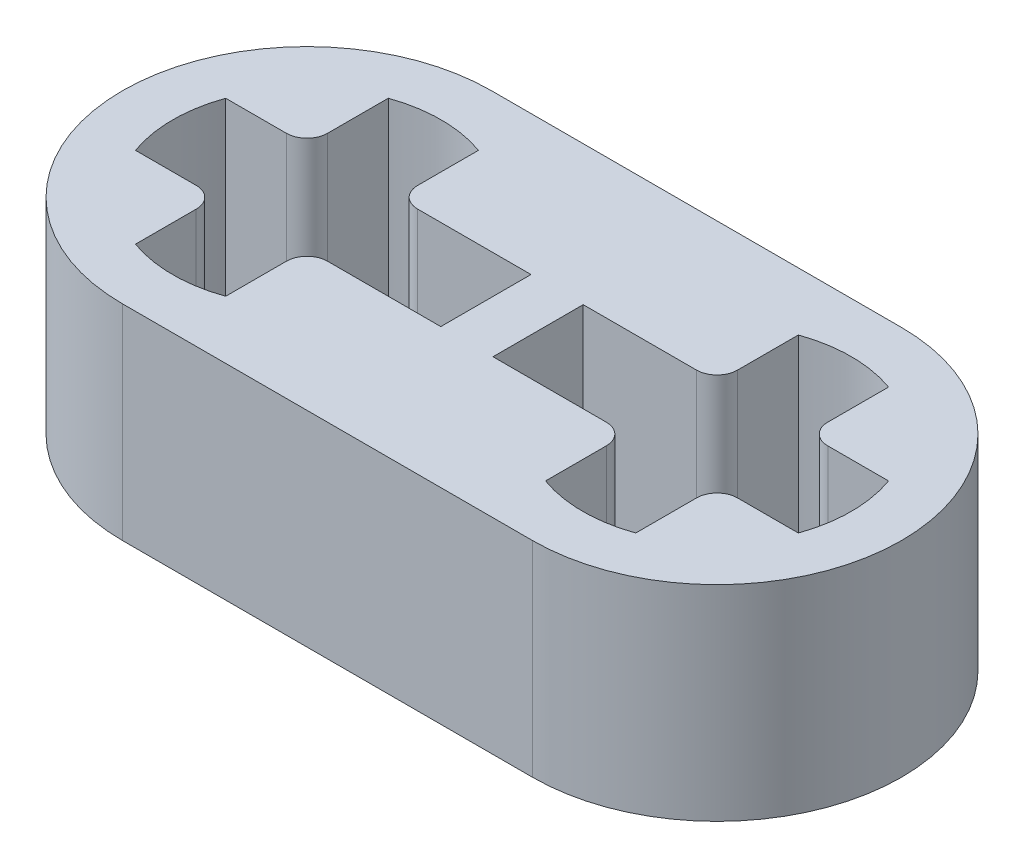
SolidWorks part; units mm, degrees
ref_plane "정면" through (0, 0, 0) normal (0, 0, 1) x (1, 0, 0)
ref_plane "윗면" through (0, 0, 0) normal (0, 1, 0) x (1, 0, 0)
ref_plane "우측면" through (0, 0, 0) normal (1, 0, 0) x (0, 0, -1)
ref_plane "평면1" through (0, 0, 0) normal (0, -1, 0) x (1, 0, 0)
sketch "스케치1" plane through (0, 0, 0) normal (0, -1, 0) x (1, 0, 0)
  line L0 (-4, -3.6) -> (4, -3.6)
  line L1 (4, 3.6) -> (-4, 3.6)
  arc A0 (4, -3.6) -> (4, 3.6) centre (4, 0) ccw
  arc A1 (-4, 3.6) -> (-4, -3.6) centre (-4, 0) ccw
  point P6 (0, 0)
  dimension "D2" = 3.6
  dimension "D3" = 4
  dimension "D1" = 8
extrude "보스-돌출1" add sketch "스케치1" against normal blind 4
sketch "스케치2" plane through (0, 0, 0) normal (0, -1, 0) x (1, 0, 0)
  line L0 (-0.5092, 0.88) -> (-3.12, 0.88)
  line L1 (-3.12, 0.88) -> (-3.12, 2.4659)
  line L2 (-4.88, 2.4659) -> (-4.88, 0.88)
  line L3 (-4.88, 0.88) -> (-6.4659, 0.88)
  line L4 (-6.4659, -0.88) -> (-4.88, -0.88)
  line L5 (-4.88, -0.88) -> (-4.88, -2.4659)
  line L6 (-3.12, -2.4659) -> (-3.12, -0.88)
  line L7 (-3.12, -0.88) -> (-0.5092, -0.88)
  line L10 (-0.5092, -0.88) -> (-0.5092, 0.88)
  arc A0 (-3.12, 2.4659) -> (-4.88, 2.4659) centre (-4, 0) ccw
  arc A1 (-6.4659, 0.88) -> (-6.4659, -0.88) centre (-4, 0) ccw
  arc A2 (-4.88, -2.4659) -> (-3.12, -2.4659) centre (-4, 0) ccw
  dimension "D1" = 4
extrude "컷-돌출1" cut sketch "스케치2" against normal through all
sketch "스케치3" plane through (0, 4, 0) normal (0, 1, 0) x (-1, 0, 0)
  line L1 (-0.5092, 0.88) -> (-3.12, 0.88)
  line L2 (-3.12, 0.88) -> (-3.12, 2.4659)
  line L3 (-4.88, 2.4659) -> (-4.88, 0.88)
  line L4 (-4.88, 0.88) -> (-6.4659, 0.88)
  line L5 (-6.4659, -0.88) -> (-4.88, -0.88)
  line L6 (-4.88, -0.88) -> (-4.88, -2.4659)
  line L7 (-3.12, -2.4659) -> (-3.12, -0.88)
  line L8 (-3.12, -0.88) -> (-0.5092, -0.88)
  line L10 (-0.5092, 0.88) -> (-0.5092, -0.88)
  arc A1 (-3.12, 2.4659) -> (-4.88, 2.4659) centre (-4, 0) ccw
  arc A2 (-6.4659, 0.88) -> (-6.4659, -0.88) centre (-4, 0) ccw
  arc A3 (-4.88, -2.4659) -> (-3.12, -2.4659) centre (-4, 0) ccw
  point P0 (0, 0)
  dimension "D1" = 4
extrude "컷-돌출2" cut sketch "스케치3" against normal through all
sketch "스케치4" plane through (0, 0, 0) normal (0, 0, 1) x (1, 0, 0)
  line L0 (3, 4) -> (0, 4)
  line L1 (0, 4) -> (0, 0)
  line L2 (0, 0) -> (3, 0)
  line L3 (3, 0) -> (3, 0.4)
  line L4 (3, 0.4) -> (2.6182, 0.4)
  line L5 (2.6182, 0.4) -> (2.6182, 3.6)
  line L6 (2.6182, 3.6) -> (3, 3.6)
  line L7 (3, 3.6) -> (3, 4)
  line L8 (0, 4) -> (0, 0) construction
fillet "필렛1" radius 0.4 8 edges at (-3.12, 2, -0.88) (3.12, 2, 0.88) (3.12, 2, -0.88) (4.88, 2, 0.88) (-3.12, 2, 0.88) (-4.88, 2, 0.88) (4.88, 2, -0.88) (-4.88, 2, -0.88)
